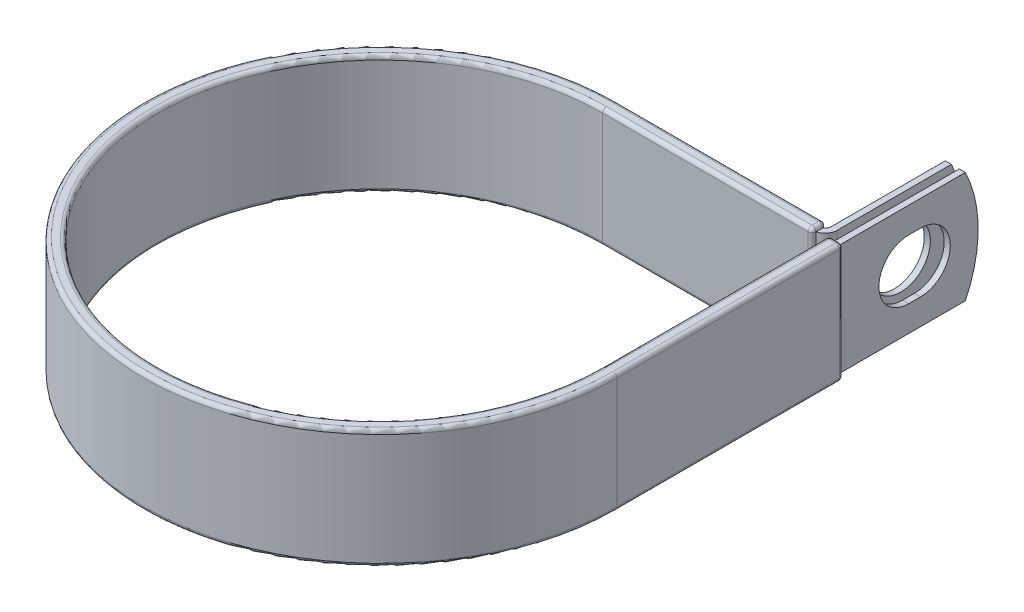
SolidWorks part; units mm, degrees
ref_plane "Front Plane" through (0, 0, 0) normal (0, 0, 1) x (1, 0, 0)
ref_plane "Top Plane" through (0, 0, 0) normal (0, 1, 0) x (1, 0, 0)
ref_plane "Right Plane" through (0, 0, 0) normal (1, 0, 0) x (0, 0, -1)
sketch "Sketch1" plane through (0, 0, 0) normal (0, 1, 0) x (1, 0, 0)
  line L0 (0, 45.2437) -> (41.2915, 45.2437)
  line L1 (45.2437, 0) -> (45.2437, 45.2437)
  line L2 (43.6689, 73.025) -> (43.669, 47.6212)
  line L5 (45.2437, 45.2437) -> (45.2437, 73.025)
  arc A0 (0, 45.2437) -> (45.2437, 0) centre (0, 0) ccw
  arc A3 (41.2915, 45.2437) -> (43.669, 47.6212) centre (41.2915, 47.6212) ccw
extrude "Extrude-Thin1" add sketch "Sketch1" along normal mid plane 22.225 thin
sketch "Sketch2" plane through (42.4498, 0, 0) normal (-1, 0, 0) x (0, 0, 1)
  line L0 (-73.025, 11.1125) -> (-73.025, -11.1125) construction
  line L7 (0, 11.1125) -> (0, -11.1125) construction
  circle A0 centre (-60.325, 0) radius 5.9436
  point P2 (-73.025, 0)
extrude "Cut-Extrude1" cut sketch "Sketch2" against normal up to surface (1.2192 mm away)
sketch "Sketch3" plane through (46.4629, 0, 0) normal (1, 0, 0) x (0, 0, -1)
  line L0 (59.1312, 0) -> (61.5188, 0) construction
  line L1 (59.1312, 5.9436) -> (61.5188, 5.9436)
  line L2 (59.1312, -5.9436) -> (61.5188, -5.9436)
  line L3 (73.025, 11.1125) -> (73.025, -11.1125) construction
  arc A0 (59.1312, 5.9436) -> (59.1312, -5.9436) centre (59.1312, 0) ccw
  arc A1 (61.5188, -5.9436) -> (61.5188, 5.9436) centre (61.5188, 0) ccw
  point P3 (60.325, 0)
  point P8 (73.025, 0)
  point P11 (53.1876, 0)
  point P12 (67.4624, 0)
extrude "Cut-Extrude2" cut sketch "Sketch3" against normal up to surface (1.2192 mm away)
sketch "Sketch4" plane through (42.4498, 0, 0) normal (-1, 0, 0) x (0, 0, 1)
  line L0 (-73.025, 11.1125) -> (-73.025, -11.1125)
  line L1 (-73.025, 11.1125) -> (-70.4651, 11.1125)
  line L2 (-73.025, 11.1125) -> (-47.6212, 11.1125) construction
  line L3 (-73.025, -11.1125) -> (-70.4651, -11.1125)
  line L4 (-73.025, -11.1125) -> (-47.6212, -11.1125) construction
  arc A0 (-70.4651, 11.1125) -> (-70.4651, -11.1125) centre (-47.625, 0) ccw
extrude "Cut-Extrude3" cut sketch "Sketch4" against normal through all contours A0 M4 M5 | A0 L0 M2
ref_plane "Plane1" through (0, 0, -45.2437) normal (0, 0, 1) x (1, 0, 0)
ref_plane "Plane2" through (0, 0, 0) normal (-1, 0, 0) x (0, 0, 1)
sketch "Sketch5" plane through (0, 0, -45.2437) normal (0, 0, 1) x (1, 0, 0)
  line L0 (45.2437, 11.1125) -> (46.4629, 11.1125)
  line L1 (45.2437, -11.1125) -> (45.2437, 11.1125)
  line L2 (44.45, -11.1442) -> (44.45, 11.1442)
  line L3 (46.4629, 11.1125) -> (46.4629, -11.1125)
  line L4 (46.4629, -11.1125) -> (45.2437, -11.1125)
  line L5 (45.212, 11.9062) -> (46.4947, 11.9062)
  line L7 (47.2567, 11.1442) -> (47.2567, -11.1442)
  line L8 (46.4947, -11.9062) -> (45.212, -11.9062)
  line L9 (44.45, -11.9062) -> (44.45, 11.9062) construction
  line L11 (47.2567, -11.9062) -> (44.45, -11.9062) construction
  line L12 (47.2567, 11.9062) -> (47.2567, -11.9062) construction
  line L13 (44.45, 11.9062) -> (47.2567, 11.9062) construction
  arc A0 (44.45, -11.1442) -> (45.212, -11.9062) centre (45.212, -11.1442) ccw
  arc A1 (47.2567, -11.1442) -> (46.4947, -11.9062) centre (46.4947, -11.1442) cw
  arc A2 (44.45, 11.1442) -> (45.212, 11.9062) centre (45.212, 11.1442) cw
  arc A3 (46.4947, 11.9062) -> (47.2567, 11.1442) centre (46.4947, 11.1442) cw
sketch "Sketch6" plane through (0, 11.1125, 0) normal (0, 1, 0) x (1, 0, 0)
  line L0 (44.45, 0) -> (44.45, 45.2437)
  line L1 (0, 44.45) -> (41.8148, 44.45)
  line L2 (42.4498, 70.4651) -> (42.4498, 47.6212) construction
  arc A0 (0, 44.45) -> (44.45, 0) centre (0, 0) ccw
sweep "Sweep1" add profiles "Sketch5" path "Sketch6"
fillet "Fillet1" radius 0.762 16 edges at (41.8148, 11.6831, -47.0335) (41.8148, 0, -47.2567) (41.8148, -11.6831, -47.0335) (41.8148, -11.9062, -45.8533) (41.8148, -11.6831, -44.6732) (41.8148, 0, -44.45) (41.8148, 11.6831, -44.6732) (47.0335, 11.6831, -45.2437) (47.2567, 0, -45.2437) (47.0335, -11.6831, -45.2437) (45.8533, -11.9062, -45.2437) (44.6732, -11.6831, -45.2437) (44.45, 0, -45.2437) (44.6732, 11.6831, -45.2437) (41.8148, 11.9062, -45.8533) (45.8533, 11.9062, -45.2437)
equation "\"D4@Sketch5\" = \"D1@Extrude-Thin1\""
equation "\"D5@Sketch5\" = \"D5@Extrude-Thin1\""
equation "\"D1@Sketch3\" = \"D2@Sketch2\""
equation "\"D7@Sketch1\" = \"D3@Sketch2\" + \"D1@Sketch3\""
equation "\"D1@Sketch1\" = \"D1@Sketch6\" + 2 * \"D3@Sketch5\""
equation "\"D1@Sketch4\" = ( \"D1@Extrude-Thin1\" + .125 ) * 2"
equation "\"D2@Sketch1\"=1.95*\"D5@Extrude-Thin1\""
equation "\"D2@Sketch3\" = \"D1@Sketch2\""
